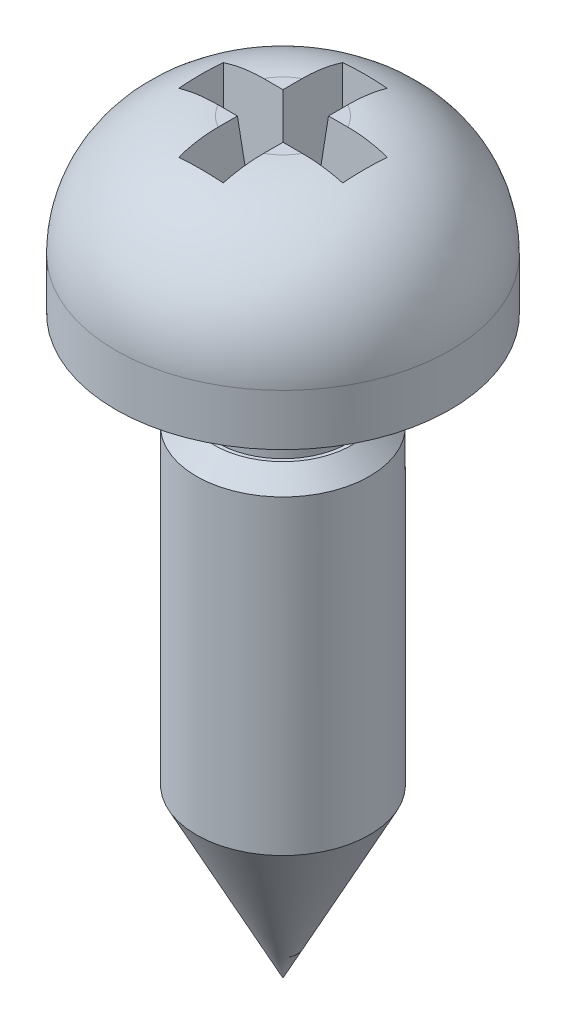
SolidWorks part; units mm, degrees
ref_plane "Face" through (0, 0, 0) normal (0, 0, 1) x (1, 0, 0)
ref_plane "Dessus" through (0, 0, 0) normal (0, 1, 0) x (1, 0, 0)
ref_plane "Droite" through (0, 0, 0) normal (1, 0, 0) x (0, 0, -1)
sketch "Esquisse1" plane through (0, 0, 0) normal (0, 0, 1) x (1, 0, 0)
  line L0 (0, 31.7451) -> (0, -19.0471) construction
  line L1 (0, -3.4482) -> (2.8, -3.4482)
  line L2 (1.45, -7.6482) -> (1.45, -13.1482)
  line L3 (1.09, -7.6482) -> (1.09, -6.3075)
  line L4 (1.09, -6.3075) -> (2.8, -6.3075)
  line L5 (1.09, -7.6482) -> (1.45, -7.6482)
  line L6 (2.8, -6.3075) -> (2.8, -3.4482)
  line L7 (1.45, -13.1482) -> (0, -15.9482)
  line L8 (0, -3.4482) -> (0, -15.9482)
  dimension "D1" = 3.1532
  dimension "D2" = 2.8593
  dimension "D3" = 1.3407
  dimension "D4" = 0.36
  dimension "D5" = 2.8
  dimension "D6" = 12.5
  dimension "D7" = 1.71
revolve "Révolution1" add sketch "Esquisse1" angle 360 about L0
chamfer "Chanfrein2" distance 0.3 angle 45 1 edges at (0, -7.6482, 1.45)
sketch "Esquisse2" plane through (0, -3.4482, 0) normal (0, 1, 0) x (-1, 0, 0)
  line L0 (0, 3.144) -> (0, -3.0562) construction
  line L1 (3.2044, 0) -> (-3.2702, 0) construction
  line L2 (0.25, -1.25) -> (-0.25, -1.25)
  line L3 (-0.25, -1.25) -> (-0.25, -0.25)
  line L4 (-1.25, -0.25) -> (-1.25, 0.25)
  line L5 (-1.25, 0.25) -> (-0.25, 0.25)
  line L6 (-0.25, 0.25) -> (-0.25, 1.25)
  line L7 (-0.25, 1.25) -> (0.25, 1.25)
  line L8 (0.25, 1.25) -> (0.25, 0.25)
  line L9 (0.25, 0.25) -> (1.25, 0.25)
  line L10 (1.25, 0.25) -> (1.25, -0.25)
  line L11 (1.25, -0.25) -> (0.25, -0.25)
  line L12 (0.25, -0.25) -> (0.25, -1.25)
  line L13 (-0.25, -0.25) -> (-1.25, -0.25)
  dimension "D1" = 0.5
  dimension "D2" = 0.5
  dimension "D3" = 0.5
  dimension "D4" = 1
  dimension "D5" = 1
extrude "Enlèv. mat.-Extru.1" cut sketch "Esquisse2" against normal blind 1.5
draft "Dépouille1" type of draft neutral plane draft angle 5 faces to draft 12 parameters "D1"=5
fillet "Congé1" radius 2 5 edges at (-1.3812, -3.4482, 0) (0, -3.4482, 1.3812) (1.3812, -3.4482, 0) (0, -3.4482, -1.3812) (0, -3.4482, 2.8)
chamfer "Chanfrein3" distance 0.25 angle 45 1 edges at (0, -6.3075, 1.09)
